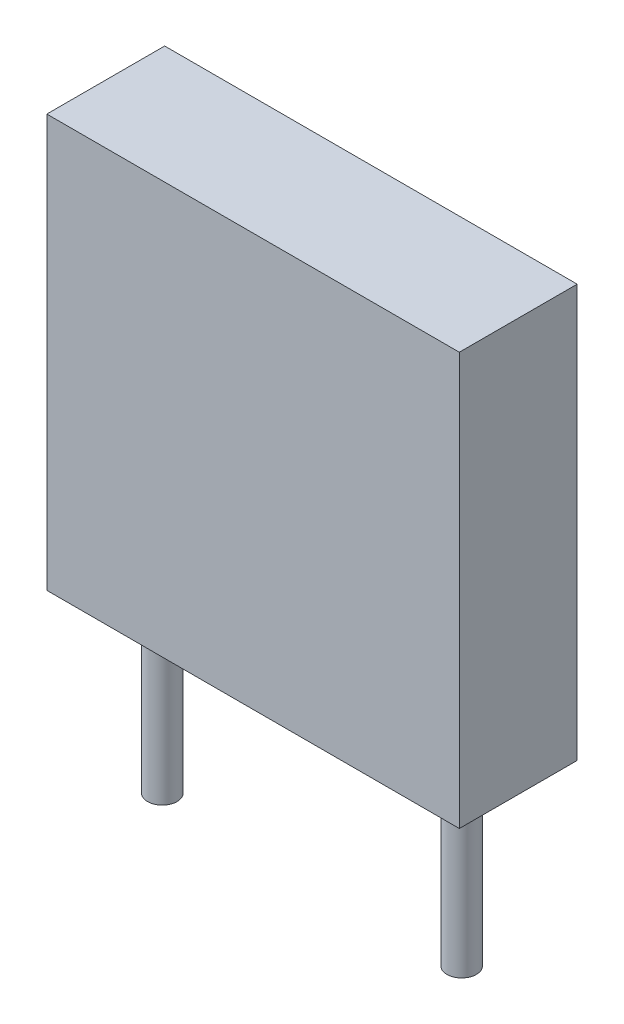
SolidWorks part; units mm, degrees
ref_plane "Plan de face" through (0, 0, 0) normal (0, 0, 1) x (1, 0, 0)
ref_plane "Plan de dessus" through (0, 0, 0) normal (0, 1, 0) x (1, 0, 0)
ref_plane "Plan de droite" through (0, 0, 0) normal (1, 0, 0) x (0, 0, -1)
sketch "Esquisse1" plane through (0, 0, 0) normal (0, 1, 0) x (1, 0, 0)
  line L1 (0, 0) -> (7, 0)
  line L2 (0, 0) -> (0, 2)
  line L3 (0, 2) -> (7, 2)
  line L4 (7, 0) -> (7, 2)
extrude "Extrusion1" add sketch "Esquisse1" along normal blind 7
sketch "Esquisse2" plane through (0, 0, 0) normal (0, -1, 0) x (1, 0, 0)
  line L0 (-0.434, 0) -> (7.2158, 0) construction
  line L1 (-0.434, -1) -> (5.1331, -1) construction
  line L2 (3.5, 1.0397) -> (3.5, -3.7606) construction
  line L3 (0, 0.729) -> (0, -2.8017) construction
  circle A0 centre (0.96, -1) radius 0.25
  circle A1 centre (6.04, -1) radius 0.25
  dimension "D1" = 3.5
  dimension "D2" = 1
extrude "Extrusion2" add sketch "Esquisse2" along normal blind 3
